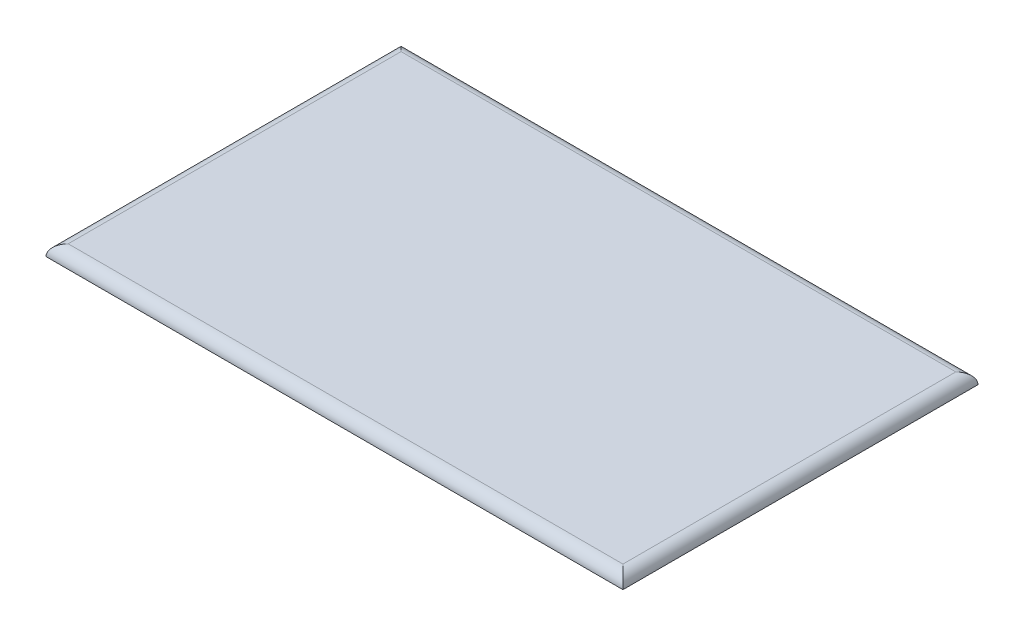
SolidWorks part; units mm, degrees
ref_plane "Front" through (0, 0, 0) normal (0, 0, 1) x (1, 0, 0)
ref_plane "Top" through (0, 0, 0) normal (0, 1, 0) x (1, 0, 0)
ref_plane "Right" through (0, 0, 0) normal (1, 0, 0) x (0, 0, -1)
sketch "Sketch1" plane through (0, 0, 0) normal (0, 1, 0) x (1, 0, 0)
  line L1 (165.1, 101.6) -> (-165.1, 101.6)
  line L2 (165.1, 101.6) -> (165.1, -101.6)
  line L3 (165.1, -101.6) -> (-165.1, -101.6)
  line L4 (-165.1, 101.6) -> (-165.1, -101.6)
  line L5 (165.1, 101.6) -> (-165.1, -101.6) construction
  line L6 (165.1, -101.6) -> (-165.1, 101.6) construction
  point P0 (0, 0)
  dimension "D1" = 203.2
  dimension "D2" = 330.2
extrude "Boss-Extrude1" add sketch "Sketch1" along normal blind 6.35
fillet "Fillet1" radius 6.35 4 edges at (0, 6.35, -101.6) (165.1, 6.35, 0) (0, 6.35, 101.6) (-165.1, 6.35, 0)
